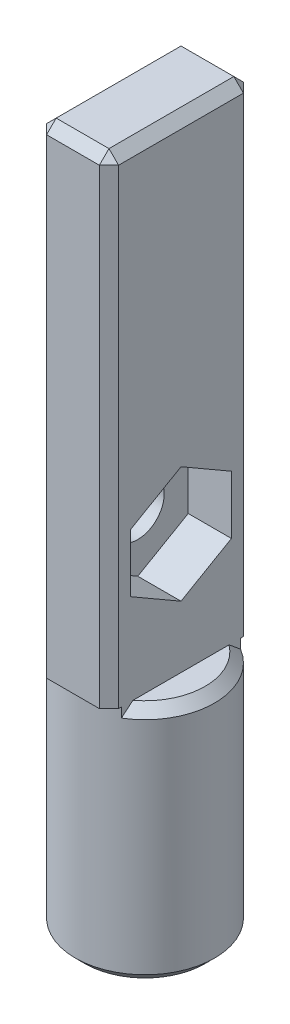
SolidWorks part; units mm, degrees
ref_plane "Front Plane" through (0, 0, 0) normal (0, 0, 1) x (1, 0, 0)
ref_plane "Top Plane" through (0, 0, 0) normal (0, 1, 0) x (1, 0, 0)
ref_plane "Right Plane" through (0, 0, 0) normal (1, 0, 0) x (0, 0, -1)
sketch "Sketch1" plane through (0, 0, 0) normal (0, 1, 0) x (1, 0, 0)
  circle A1 centre (0, 0) radius 2.9
extrude "Boss-Extrude1" add sketch "Sketch1" along normal blind 10
sketch "Sketch2" plane through (0, 0, 0) normal (0, -1, 0) x (1, 0, 0)
  circle A0 centre (0, 0) radius 2.1
extrude "Cut-Extrude1" cut sketch "Sketch2" against normal blind 8
sketch "Sketch3" plane through (0, 10, 0) normal (0, 1, 0) x (1, 0, 0)
  line L1 (-1.5, -3) -> (1.5, -3)
  line L2 (-1.5, -3) -> (-1.5, 3)
  line L3 (-1.5, 3) -> (1.5, 3)
  line L4 (1.5, -3) -> (1.5, 3)
  point P4 (0, 0)
  point P5 (0, 0)
extrude "Boss-Extrude2" add sketch "Sketch3" along normal blind 20
chamfer "Chamfer1" distance 0.4 angle 45 8 edges at (1.5, 20, 3) (-1.5, 20, 3) (0, 30, 3) (1.5, 30, 0) (1.5, 20, -3) (0, 30, -3) (-1.5, 30, 0) (-1.5, 20, -3)
sketch "Sketch4" plane through (1.5, 0, 0) normal (1, 0, 0) x (0, 0, -1)
  line L7 (-2.1, 16.2124) -> (0, 17.4249)
  line L8 (-2.1, 13.7876) -> (-2.1, 16.2124)
  line L10 (0, 12.5751) -> (-2.1, 13.7876)
  line L12 (2.1, 13.7876) -> (0, 12.5751)
  line L14 (2.1, 16.2124) -> (2.1, 13.7876)
  line L16 (0, 17.4249) -> (2.1, 16.2124)
  point P17 (0, 15)
extrude "Cut-Extrude2" cut sketch "Sketch4" against normal blind 1.8
sketch "Sketch5" plane through (1.5, 0, 0) normal (1, 0, 0) x (0, 0, -1)
  circle A0 centre (0, 15) radius 1.1
extrude "Cut-Extrude3" cut sketch "Sketch5" against normal blind 11.8
chamfer "Chamfer3" distance 0.4 angle 45 3 edges at (2.9, 10, 0) (-2.9, 10, 0) (0, 0, 2.9)
